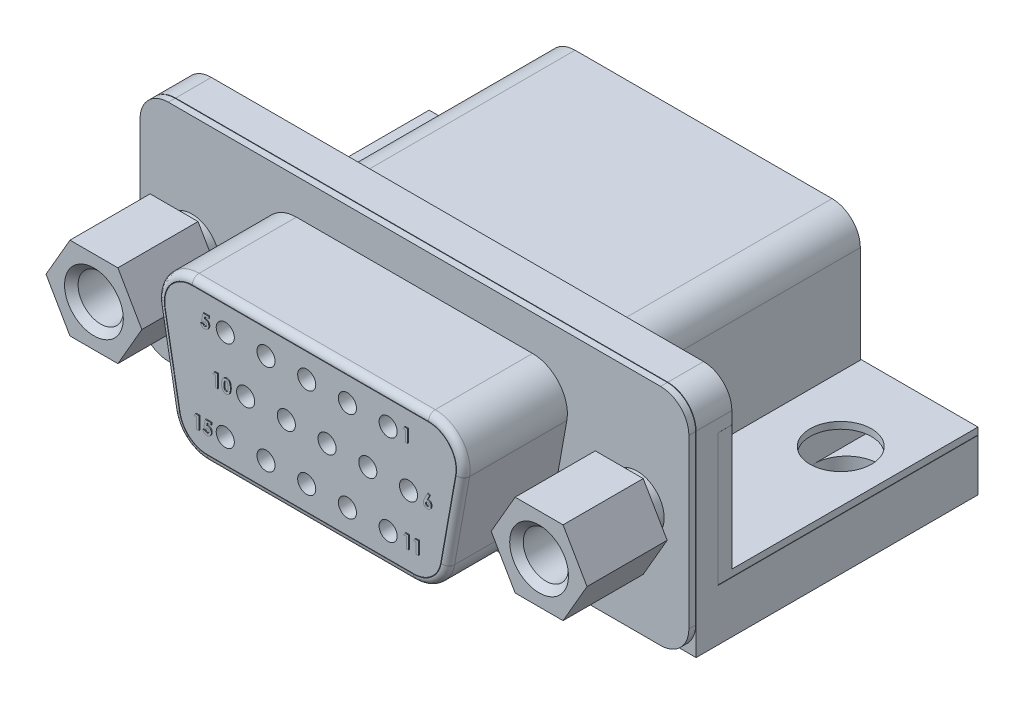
SolidWorks part; units mm, degrees
ref_plane "Front" through (0, 0, 0) normal (0, 0, 1) x (1, 0, 0)
ref_plane "Top" through (0, 0, 0) normal (0, 1, 0) x (1, 0, 0)
ref_plane "Right" through (0, 0, 0) normal (1, 0, 0) x (0, 0, -1)
imported_body "Импортированный1"
ref_plane "Плоскость1" through (0, 6.2992, 0) normal (0, 1, 0) x (-1, 0, 0)
sketch "Эскиз1" plane through (0, 6.2992, 0) normal (0, 1, 0) x (-1, 0, 0)
  line L0 (12.4968, -0.8636) -> (12.4968, -2.4257) construction
  line L1 (12.4968, 1.7188) -> (12.4968, -3.6957) construction
  line L2 (12.4968, -3.6957) -> (13.8938, -3.6957)
  line L3 (13.8938, -3.6957) -> (13.8938, 1)
  line L4 (13.8938, 1) -> (14.8268, 1)
  line L5 (14.8268, 1) -> (14.8268, 5.5)
  line L6 (14.8268, 5.5) -> (14.1478, 5.5)
  line L7 (13.7668, 5.119) -> (13.7668, 2.452)
  line L8 (13.7668, 2.452) -> (12.4968, 1.7188)
  line L10 (15.4051, 0) -> (13.8176, 0) construction
  line L11 (15.4076, -2.4257) -> (8.8544, -2.4257) construction
  line L12 (12.4968, 1.7188) -> (12.4968, -3.6957)
  line L13 (14.1478, 5.5) -> (13.7668, 5.119)
  point P9 (13.7668, 5.5)
  dimension "D1" = 2.794
  dimension "D2" = 1
  dimension "D3" = 4.66
  dimension "D4" = 4.5
  dimension "D5" = 2.54
  dimension "D6" = 60
  dimension "D7" = 3.048
  dimension "D8" = 1.27
  dimension "D11" = 0.381
revolve "Повернуть1" add sketch "Эскиз1" angle 360 about L1
sketch "Эскиз2" plane through (0, 0, 5.5) normal (0, 0, 1) x (1, 0, 0)
  line L1 (-11.1516, 8.6292) -> (-13.842, 8.6292)
  line L2 (-13.842, 8.6292) -> (-15.1873, 6.2992)
  line L3 (-15.1873, 6.2992) -> (-13.842, 3.9692)
  line L4 (-13.842, 3.9692) -> (-11.1516, 3.9692)
  line L5 (-11.1516, 3.9692) -> (-9.8063, 6.2992)
  line L6 (-9.8063, 6.2992) -> (-11.1516, 8.6292)
  circle A0 centre (-12.4968, 6.2992) radius 2.33 construction
  circle A1 centre (-12.4968, 6.2992) radius 2.33 construction
  circle A2 centre (-12.4968, 6.2992) radius 1.651 construction
  circle A3 centre (-12.4968, 6.2992) radius 1.651
extrude "Вытянуть1" add sketch "Эскиз2" against normal up to surface (4.5 mm away)
mirror "Зеркальное отражение1" about plane through (0, 0, 0) normal (1, 0, 0) of "Повернуть1", "Вытянуть1"
